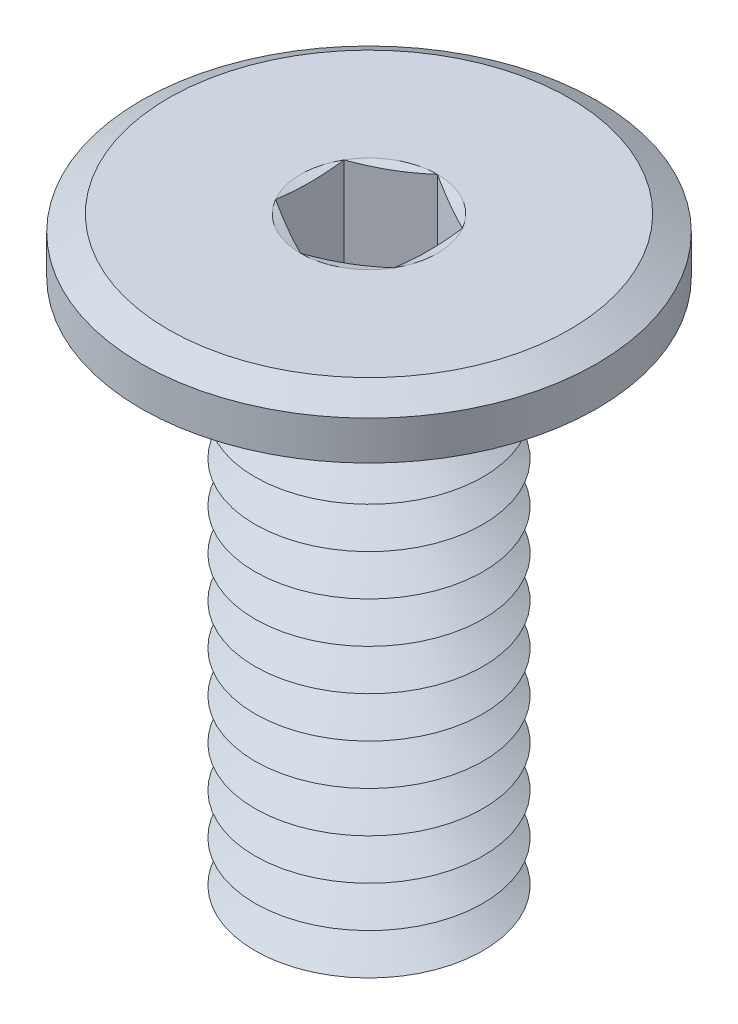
SolidWorks part; units mm, degrees
ref_plane "Front Plane" through (0, 0, 0) normal (0, 0, 1) x (1, 0, 0)
ref_plane "Top Plane" through (0, 0, 0) normal (0, 1, 0) x (1, 0, 0)
ref_plane "Right Plane" through (0, 0, 0) normal (1, 0, 0) x (0, 0, -1)
sketch "Sketch1" plane through (0, 0, 0) normal (0, 1, 0) x (1, 0, 0)
  circle A0 centre (0, 0) radius 2.5
  dimension "D1" = 5
extrude "Boss-Extrude1" add sketch "Sketch1" against normal blind 0.6
sketch "Sketch2" plane through (0, -0.6, 0) normal (0, -1, 0) x (1, 0, 0)
  circle A0 centre (0, 0) radius 1.25
  dimension "D1" = 2.5
extrude "Boss-Extrude2" add sketch "Sketch2" along normal blind 6
sketch "Sketch3" plane through (0, 0, 0) normal (1, 0, 0) x (0, 0, -1)
  line L0 (0, 0.9906) -> (0, -8.2999) construction
sketch "Sketch5" plane through (0, 0, 0) normal (1, 0, 0) x (0, 0, -1)
  line L0 (-1.25, -6.825) -> (-0.8603, -6.6)
  line L1 (-1.25, -0.6) -> (-1.25, -6.6) construction
  line L2 (-0.8603, -6.6) -> (-1.25, -6.375)
  line L3 (-1.25, -0.6) -> (-1.25, -6.6) construction
  line L4 (-1.25, -6.375) -> (-1.25, -6.825)
  line L6 (-1.25, -0.6) -> (-1.25, -6.6) construction
  line L7 (-1.25, -0.6) -> (-1.25, -6.6) construction
  line L14 (-1.25, -6.6) -> (1.25, -6.6) construction
  dimension "D1" = 0.45
revolve "Cut-Revolve1" cut sketch "Sketch5" angle 360 about L0
pattern_linear "LPattern1" count 12 spacing 0.45 along (0, 1, 0) of "Cut-Revolve1"
fillet "Fillet1" radius 0.1 1 edges at (0, -0.6, -1.25)
chamfer "Chamfer2" distance 0.3 angle 30 1 edges at (0, 0, 2.5)
sketch "Sketch6" plane through (0, 0, 0) normal (0, 1, 0) x (1, 0, 0)
  line L1 (0, 0.7506) -> (-0.65, 0.3753)
  line L2 (-0.65, 0.3753) -> (-0.65, -0.3753)
  line L3 (-0.65, -0.3753) -> (0, -0.7506)
  line L4 (0, -0.7506) -> (0.65, -0.3753)
  line L5 (0.65, -0.3753) -> (0.65, 0.3753)
  line L6 (0.65, 0.3753) -> (0, 0.7506)
  circle A0 centre (0, 0) radius 0.65 construction
  dimension "D1" = 1.3
extrude "Cut-Extrude1" cut sketch "Sketch6" against normal blind 1.2
sketch "Sketch7" plane through (0, -1.2, 0) normal (0, 1, 0) x (1, 0, 0)
  line L0 (-0.65, 0.3753) -> (-0.65, -0.3753) construction
  circle A0 centre (0, 0) radius 0.65
extrude "Cut-Extrude2" cut sketch "Sketch7" against normal through all draft 60
sketch "Sketch8" plane through (0, 0, 0) normal (0, 1, 0) x (1, 0, 0)
  circle A0 centre (0, 0) radius 0.7506
extrude "Cut-Extrude3" cut sketch "Sketch8" against normal through all draft 75
